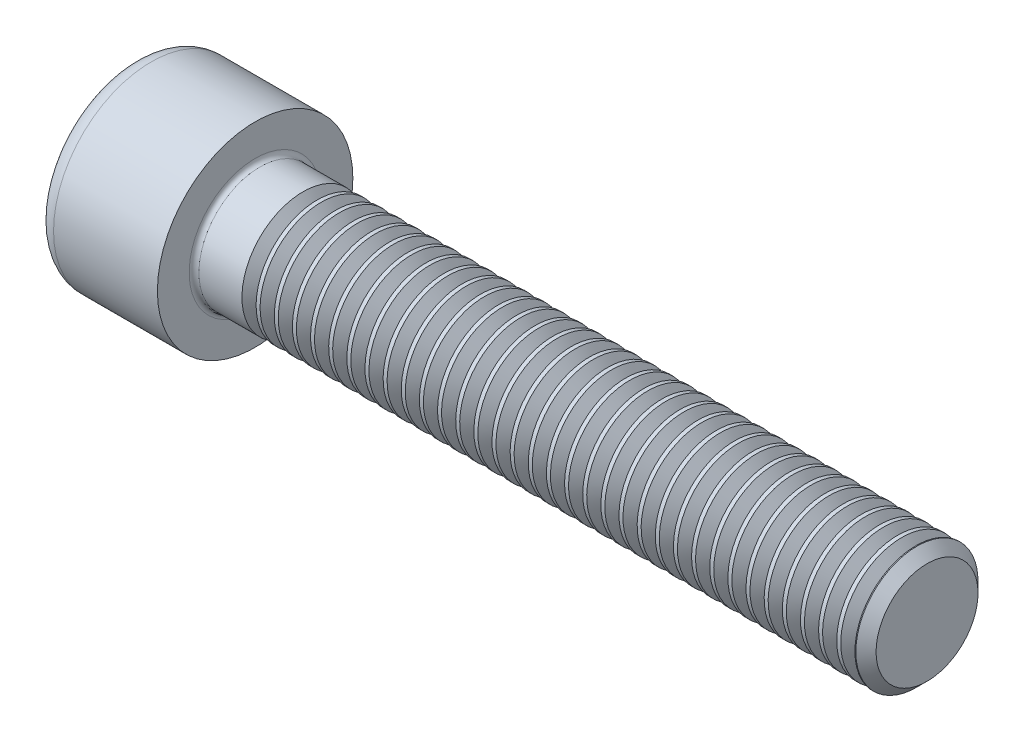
SolidWorks part; units mm, degrees
ref_plane "Plane1" through (0, 0, 0) normal (0, 0, 1) x (1, 0, 0)
ref_plane "Plane2" through (0, 0, 0) normal (0, 1, 0) x (1, 0, 0)
ref_plane "Plane3" through (0, 0, 0) normal (1, 0, 0) x (0, 0, -1)
revolve "Base-Revolve" add sketch "BodySke"
sketch "BodySke" plane through (0, 0, 0) normal (0, 0, 1) x (1, 0, 0)
  line L0 (0, 0) -> (0, 8)
  line L1 (0, 8) -> (10, 8)
  line L2 (10, 8) -> (10, 5)
  line L3 (10, 5) -> (64.172, 5)
  line L4 (65, 4.172) -> (65, 0)
  line L5 (65, 0) -> (0, 0)
  line L6 (-31.75, 0) -> (127, 0) construction
  line L8 (65, 4.172) -> (64.172, 5)
  line L10 (65, -4.172) -> (64.172, -5) construction
  line L11 (11.5, 2.4825) -> (11.5, -3.8675) construction
  line L12 (10, 2.4825) -> (10, -3.8675) construction
  line L13 (5, 2.4825) -> (5, -3.8675) construction
  dimension "Diameter" = 10
  dimension "Head_ht" = 10
  dimension "Length" = 55
  dimension "Body_ch_ang" = 45
  dimension "Head_dia" = 16
  dimension "Minor_dia" = 8.344
  dimension "Advance" = 1.5
  dimension "Thread_nom" = 55
  dimension "Thread_length" = 60
fillet "Fillet1" radius 0.4
fillet "Fillet2" radius 1.5
sketch "Sketch2" plane through (0, 0, 0) normal (0, 0, 1) x (1, 0, 0)
  line L0 (0, 4.0575) -> (5, 4.0575)
  line L1 (5, 4.0575) -> (7.3426, 0)
  line L2 (-31.75, 0) -> (127, 0) construction
  line L3 (7.3426, 0) -> (0, 0)
  line L4 (0, 0) -> (0, 4.0575)
  line L6 (0, 0) -> (47.625, 0) construction
  dimension "D1" = 4.0575
  dimension "D2" = 60
  dimension "Depth" = 5
revolve "Hex-PreBroach" cut sketch "Sketch2" angle 360 about L6
sketch "Sketch3" plane through (0, 0, 0) normal (-1, 0, 0) x (0, 0.5, 0.866)
  line L0 (2.3426, 4.0575) -> (-2.3426, 4.0575)
  line L1 (-2.3426, 4.0575) -> (-4.6852, 0)
  line L2 (2.3426, 4.0575) -> (4.6852, 0)
  line L3 (2.3426, -4.0575) -> (4.6852, 0)
  line L4 (2.3426, -4.0575) -> (-2.3426, -4.0575)
  line L5 (-2.3426, -4.0575) -> (-4.6852, 0)
  dimension "D1" = 4.0575
  dimension "D2" = 4.0575
  dimension "Hex_size" = 8.115
extrude "Hex" cut sketch "Sketch3" against normal blind 5
sketch "ThdSchSke" plane through (0, 0, 0) normal (0, 0, 1) x (1, 0, 0)
  line L0 (14.5, -4.172) -> (13.9202, -5)
  line L1 (14.5, -4.172) -> (15.0798, -5)
  line L2 (15.0798, -5) -> (15.0798, -6.25)
  line L3 (-3.175, 0) -> (5.1513, 0) construction
  line L4 (0, 6.5) -> (0, -6.5) construction
  line L5 (15.0798, -6.25) -> (13.9202, -6.25)
  line L6 (13.9202, -6.25) -> (13.9202, -5)
  dimension "Thread_minor" = 8.344
  dimension "Diameter" = 10
  dimension "Start" = 14.5
  dimension "SideAngle" = 55
  dimension "VeeAngle" = 70
  dimension "Overcut" = 12.5
revolve "ThreadSchematic" cut sketch "ThdSchSke" angle 360 about L3
pattern_linear "ThdSchPat"
equation "\"D2@Sketch3\" = \"Hex_size@Sketch3\" / 2"
equation "\"D1@Sketch3\" = \"Hex_size@Sketch3\" / 2"
equation "\"D1@Sketch2\" = \"Hex_size@Sketch3\" / 2"
equation "\"Thread_minor@ThreadCosmetic\"  =  \"Minor_dia@BodySke\""
equation "\"Depth@Sketch2\" =  \"Key_eng@Hex\""
equation "\"Thread_length@ThreadCosmetic\" = ((sgn( (\"Length@BodySke\" - \"Advance@BodySke\" * 3.0) - \"Thread_nom@BodySke\" )-1)*( (\"Length@BodySke\" - \"Advance@BodySke\" * 3.0) - \"Thread_nom@BodySke\" ))/-2+ \"Thread_no"
equation "\"Thread_minor@ThdSchSke\" = \"Minor_dia@BodySke\""
equation "\"Diameter@ThdSchSke\" = \"Diameter@BodySke\""
equation "\"Overcut@ThdSchSke\" = \"Diameter@BodySke\" * 1.25"
equation "\"Start@ThdSchSke\" = \"Head_ht@BodySke\" + \"Length@BodySke\" - \"Thread_length@ThreadCosmetic\"  '---Non-countersunk---"
equation "\"Num_threads@ThdSchPat\" = int( \"Thread_length@ThreadCosmetic\" / \"Advance@BodySke\" + 0.999 )  + 1"
equation "\"Advance@ThdSchPat\" = \"Thread_length@ThreadCosmetic\" /  (\"Num_threads@ThdSchPat\" - 1) 'relax it"
equation "\"Num_threads@ThdSchPat\" = \"Num_threads@ThdSchPat\" - sgn( \"Num_threads@ThdSchPat\" - 1) '---chamfered tips only---"
